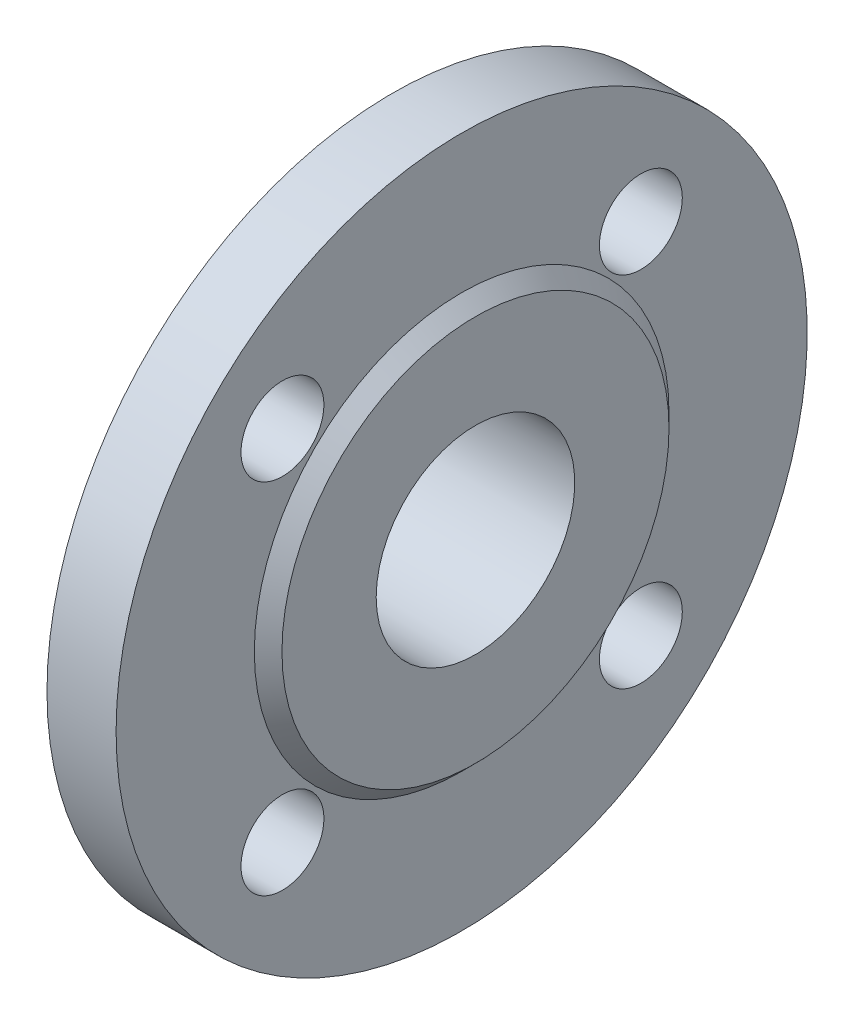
SolidWorks part; units mm, degrees
ref_plane "Plan de face" through (0, 0, 0) normal (0, 0, 1) x (1, 0, 0)
ref_plane "Plan de dessus" through (0, 0, 0) normal (0, 1, 0) x (1, 0, 0)
ref_plane "Plan de droite" through (0, 0, 0) normal (1, 0, 0) x (0, 0, -1)
sketch "Esquisse1" plane through (0, 0, 0) normal (0, 0, 1) x (1, 0, 0)
  line L0 (678, -415) -> (841, -415) construction
  line L1 (678, -439.15) -> (678, -390.85) construction
  line L2 (678, -390.85) -> (685, -390.85)
  line L3 (685, -390.85) -> (702, -383)
  line L4 (702, -383) -> (702, -340)
  line L5 (702, -340) -> (717, -340)
  line L6 (717, -340) -> (717, -370)
  line L7 (717, -370) -> (720, -373)
  line L8 (720, -373) -> (720, -393.45)
  line L9 (720, -393.45) -> (678, -393.45)
  line L10 (678, -393.45) -> (678, -390.85)
  dimension "D1" = 7
  dimension "D2" = 42
  dimension "D3" = 18
  dimension "D4" = 150
  dimension "D5" = 84
  dimension "D6" = 3
  dimension "D7" = 3
  dimension "D8" = 64
revolve "Révolution1" add sketch "Esquisse1" angle 360 about L0
sketch "Esquisse2" plane through (717, 0, 0) normal (1, 0, 0) x (0, 0, -1)
  line L0 (38.8909, -376.1091) -> (0, -415) construction
  line L1 (0, -415) -> (75, -415) construction
  circle A0 centre (38.8909, -376.1091) radius 9
  circle A1 centre (0, -415) radius 75 construction
  circle A2 centre (38.8909, -453.8909) radius 9
  circle A3 centre (-38.8909, -453.8909) radius 9
  circle A4 centre (-38.8909, -376.1091) radius 9
  dimension "D1" = 18
  dimension "D2" = 55
  dimension "D3" = 45
extrude "Extrusion1" cut sketch "Esquisse2" against normal through all
